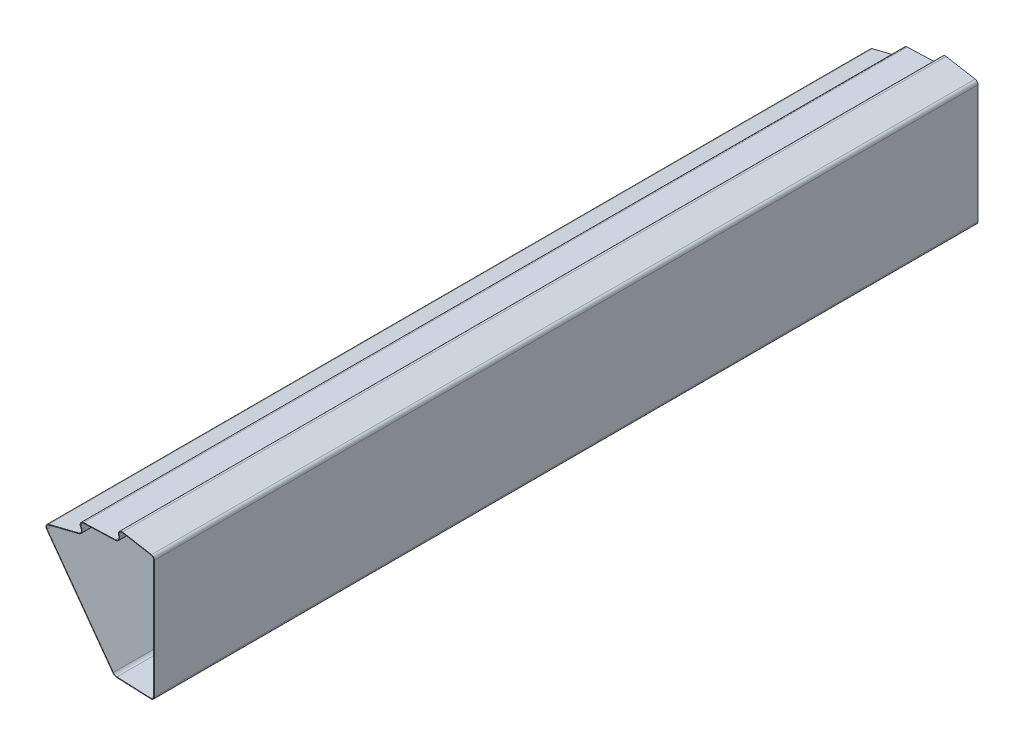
SolidWorks part; units mm, degrees
ref_plane "Front Plane" through (0, 0, 0) normal (0, 0, 1) x (1, 0, 0)
ref_plane "Top Plane" through (0, 0, 0) normal (0, 1, 0) x (1, 0, 0)
ref_plane "Right Plane" through (0, 0, 0) normal (1, 0, 0) x (0, 0, -1)
sketch "Sketch1" plane through (0, 0, 0) normal (0, 0, 1) x (1, 0, 0)
  line L0 (-16.9638, 26.5341) -> (-2.5682, 25.8793)
  line L1 (-46.8997, 66.2532) -> (-18.7351, 27.4879)
  line L2 (-46.0481, 68.5905) -> (-33.2024, 71.7845)
  line L3 (-31.1768, 76.652) -> (-17.552, 77.119)
  line L4 (-1, 77.8014) -> (-1, 27.3777)
  line L5 (-14.5587, 81.459) -> (-2.2386, 79.2785)
  line L6 (0, 0) -> (-21.3966, 104.6618) construction
  line L7 (0, 0) -> (-41.6883, 95.6295) construction
  line L8 (-52.6003, 66.9614) -> (-33.9676, 71.5943) construction
  line L9 (-1, 70.6811) -> (-1, 38.7624) construction
  line L10 (-37.5288, 76.4343) -> (-18.3401, 77.092) construction
  line L11 (-21.1016, 30.7452) -> (-44.2572, 62.6161) construction
  line L17 (-20.8171, 82.5667) -> (-1.9109, 79.2205) construction
  line L19 (-16.2897, 79.6815) -> (-16.1338, 78.9186)
  line L20 (-32.5005, 74.5535) -> (-32.1893, 73.8396)
  line L21 (-16.6758, 26.521) -> (2.5044, 25.6486) construction
  line L22 (-17.5784, 77.8902) -> (-17.552, 77.119) construction
  line L23 (-16.9638, 26.5341) -> (-16.9989, 25.7633) construction
  arc A0 (-33.2024, 71.7845) -> (-32.1893, 73.8396) centre (-33.5643, 73.2402) ccw
  arc A1 (-31.1768, 76.652) -> (-32.5005, 74.5535) centre (-31.1255, 75.1529) ccw
  arc A2 (-17.552, 77.119) -> (-16.1338, 78.9186) centre (-17.6034, 78.6181) ccw
  arc A3 (-14.5587, 81.459) -> (-16.2897, 79.6815) centre (-14.8201, 79.982) ccw
  arc A4 (-2.2386, 79.2785) -> (-1, 77.8014) centre (-2.5, 77.8014) cw
  arc A5 (-46.0481, 68.5905) -> (-46.8997, 66.2532) centre (-45.6861, 67.1348) ccw
  arc A6 (-16.9638, 26.5341) -> (-18.7351, 27.4879) centre (-16.8584, 28.8514) cw
  arc A7 (-1, 27.3777) -> (-2.5682, 25.8793) centre (-2.5, 27.3777) cw
  dimension "D1" = 1.5
  dimension "D2" = 1.5
extrude "Extrude-Thin1" add sketch "Sketch1" along normal blind 137.5002 and the other way blind 213.5 thin
